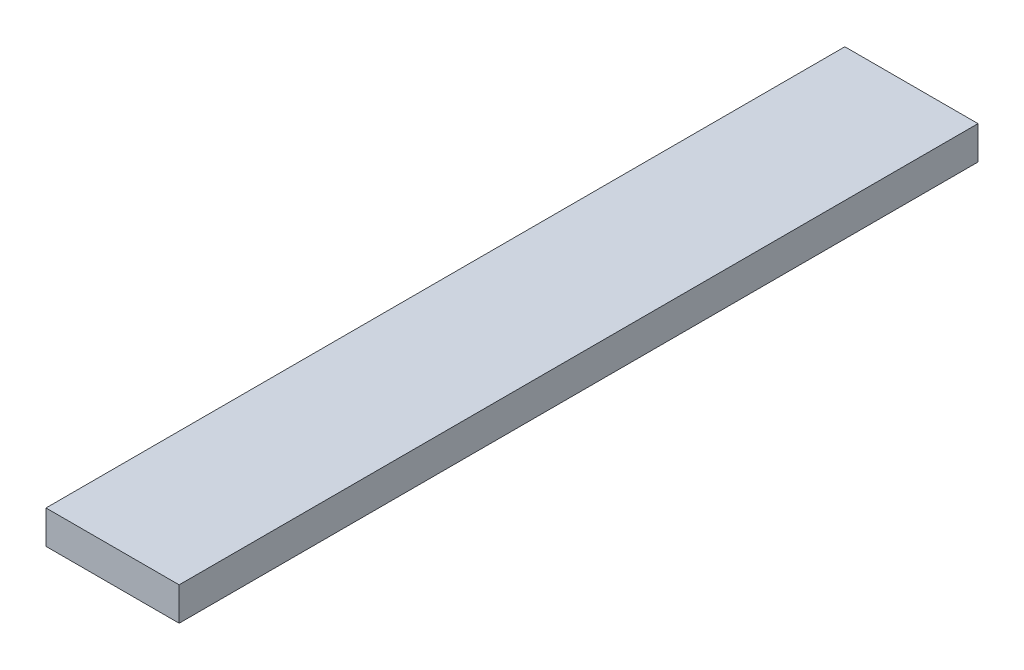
SolidWorks part; units mm, degrees
ref_plane "Plan de face" through (0, 0, 0) normal (0, 0, 1) x (1, 0, 0)
ref_plane "Plan de dessus" through (0, 0, 0) normal (0, 1, 0) x (1, 0, 0)
ref_plane "Plan de droite" through (0, 0, 0) normal (1, 0, 0) x (0, 0, -1)
sketch "Esquisse1" plane through (0, 0, 0) normal (0, 0, 1) x (1, 0, 0)
  line L1 (0, 0) -> (20, 0)
  line L2 (0, 0) -> (0, 5)
  line L3 (0, 5) -> (20, 5)
  line L4 (20, 0) -> (20, 5)
  dimension "D1" = 20
  dimension "D2" = 5
extrude "Extrusion1" add sketch "Esquisse1" along normal blind 120
